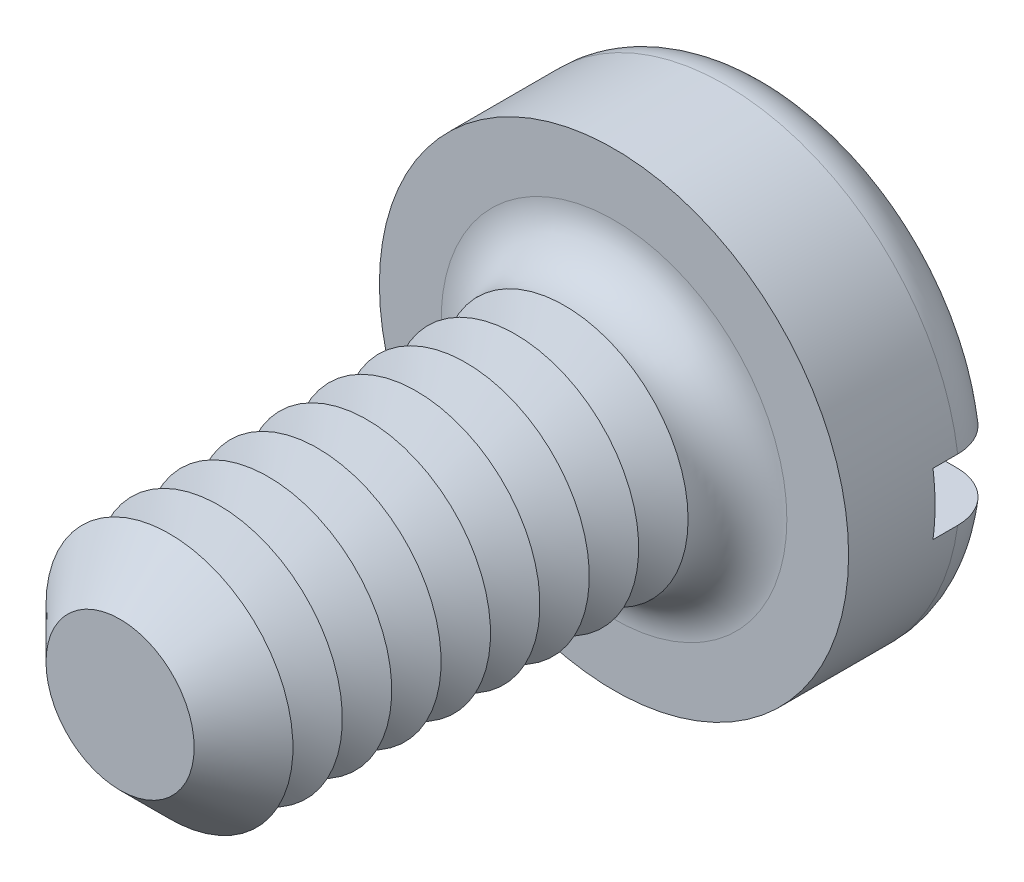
SolidWorks part; units mm, degrees
ref_plane "Front Plane" through (0, 0, 0) normal (0, 0, 1) x (1, 0, 0)
ref_plane "Top Plane" through (0, 0, 0) normal (0, 1, 0) x (1, 0, 0)
ref_plane "Right Plane" through (0, 0, 0) normal (1, 0, 0) x (0, 0, -1)
sketch "Sketch3" plane through (0, 0, 0) normal (0, 0, 1) x (1, 0, 0)
  circle A0 centre (0, 0) radius 1.9
  dimension "D1" = 3.8
extrude "Boss-Extrude2" add sketch "Sketch3" against normal blind 1.3
sketch "Sketch4" plane through (0, 0, 0) normal (0, 0, 1) x (1, 0, 0)
  circle A0 centre (0, 0) radius 1
  dimension "D1" = 2
extrude "Boss-Extrude3" add sketch "Sketch4" along normal blind 4
fillet "Fillet1" radius 0.4 2 edges at (1.9, 0, -1.3) (1, 0, 0)
chamfer "Chamfer1" distance 0.4 angle 45 1 edges at (1, 0, 4)
sketch "Sketch5" plane through (0, 0, 0) normal (1, 0, 0) x (0, 0, -1)
  line L0 (1.6944, 0) -> (-7.6738, 0) construction
sketch "Sketch6" plane through (0, 0, 0) normal (1, 0, 0) x (0, 0, -1)
  line L0 (-0.4, 1) -> (-0.6, 0.6536)
  line L1 (-0.6, 0.6536) -> (-0.8, 1)
  line L2 (-0.4, 1) -> (-3.6, 1) construction
  line L3 (-0.8, 1) -> (-0.4, 1)
  dimension "D1" = 0.4
revolve "Cut-Revolve1" cut sketch "Sketch6" angle 360 about L0
pattern_linear "LPattern1" count 8 spacing 0.4 along (0, 0, 1) of "Cut-Revolve1"
sketch "Sketch8" plane through (0, 0, -1.3) normal (0, 0, -1) x (-1, 0, 0)
  line L1 (1.9, -0.25) -> (-1.9, -0.25)
  line L2 (1.9, -0.25) -> (1.9, 0.25)
  line L3 (1.9, 0.25) -> (-1.9, 0.25)
  line L4 (-1.9, -0.25) -> (-1.9, 0.25)
  line L5 (1.9, -0.25) -> (-1.9, 0.25) construction
  line L6 (1.9, 0.25) -> (-1.9, -0.25) construction
  point P0 (0, 0)
  dimension "D1" = 3.8
  dimension "D2" = 0.5
extrude "Cut-Extrude1" cut sketch "Sketch8" against normal blind 0.6
